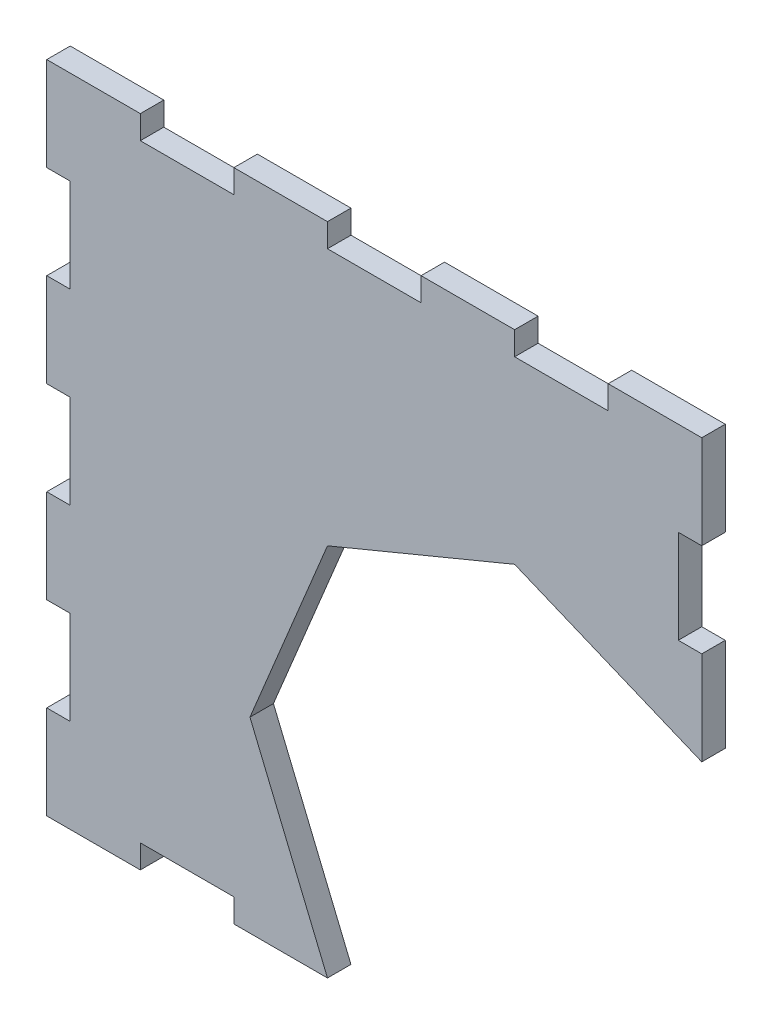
SolidWorks part; units mm, degrees
ref_plane "Front Plane" through (0, 0, 0) normal (0, 0, 1) x (1, 0, 0)
ref_plane "Top Plane" through (0, 0, 0) normal (0, 1, 0) x (1, 0, 0)
ref_plane "Right Plane" through (0, 0, 0) normal (1, 0, 0) x (0, 0, -1)
sketch "Sketch1" plane through (0, 0, 0) normal (0, 0, 1) x (1, 0, 0)
  line L11 (-882.7023, 200.2004) -> (-806.988, 200.2004)
  line L12 (-958.4166, 181.2004) -> (-882.7023, 181.2004)
  line L13 (-1185.5594, 48.7719) -> (-1185.5594, -26.9424)
  line L20 (-958.4166, 200.2004) -> (-958.4166, 181.2004)
  line L30 (-1034.1309, -329.7996) -> (-958.4166, -329.7996)
  line L32 (-1185.5594, 200.2004) -> (-1109.8452, 200.2004)
  line L34 (-1185.5594, -102.6567) -> (-1166.5594, -102.6567)
  line L36 (-1109.8452, 200.2004) -> (-1109.8452, 181.2004)
  line L37 (-1109.8452, 181.2004) -> (-1034.1309, 181.2004)
  line L39 (-1185.5594, 48.7719) -> (-1166.5594, 48.7719)
  line L40 (-731.2737, 200.2004) -> (-731.2737, 181.2004)
  line L47 (-1185.5594, 200.2004) -> (-1185.5594, 124.4861)
  line L50 (-1166.5594, -26.9424) -> (-1166.5594, -102.6567)
  line L51 (-655.5594, 48.7719) -> (-655.5594, -26.9424)
  line L52 (-731.2737, 200.2004) -> (-655.5594, 200.2004)
  line L54 (-1166.5594, 124.4861) -> (-1166.5594, 48.7719)
  line L55 (-1185.5594, -254.0853) -> (-1185.5594, -329.7996)
  line L57 (-1109.8452, -310.7996) -> (-1109.8452, -329.7996)
  line L58 (-882.7023, 200.2004) -> (-882.7023, 181.2004)
  line L59 (-1185.5594, -178.371) -> (-1166.5594, -178.371)
  line L60 (-1166.5594, -178.371) -> (-1166.5594, -254.0853)
  line L61 (-1185.5594, -254.0853) -> (-1166.5594, -254.0853)
  line L62 (-1185.5594, -26.9424) -> (-1166.5594, -26.9424)
  line L63 (-1185.5594, -329.7996) -> (-1109.8452, -329.7996)
  line L64 (-1034.1309, 200.2004) -> (-1034.1309, 181.2004)
  line L65 (-655.5594, 200.2004) -> (-655.5594, 124.4861)
  line L66 (-1185.5594, 124.4861) -> (-1166.5594, 124.4861)
  line L67 (-1109.8452, -310.7996) -> (-1034.1309, -310.7996)
  line L68 (-674.5594, 48.7719) -> (-655.5594, 48.7719)
  line L69 (-674.5594, 124.4861) -> (-655.5594, 124.4861)
  line L70 (-1185.5594, -102.6567) -> (-1185.5594, -178.371)
  line L71 (-1034.1309, 200.2004) -> (-958.4166, 200.2004)
  line L72 (-674.5594, 124.4861) -> (-674.5594, 48.7719)
  line L73 (-806.988, 181.2004) -> (-731.2737, 181.2004)
  line L74 (-806.988, 200.2004) -> (-806.988, 181.2004)
  line L75 (-1034.1309, -310.7996) -> (-1034.1309, -329.7996)
  line L76 (-958.4166, -26.9424) -> (-1021.1403, -178.371)
  line L77 (-806.988, 35.7813) -> (-958.4166, -26.9424)
  line L78 (-1021.1403, -178.371) -> (-958.4166, -329.7996)
  line L79 (-655.5594, -26.9424) -> (-806.988, 35.7813)
  arc A1 (-655.5594, -26.9424) -> (-958.4166, -329.7996) centre (-806.988, -178.371) ccw construction
  dimension "D1" = 19
extrude "Boss-Extrude2" add sketch "Sketch1" along normal blind 19
